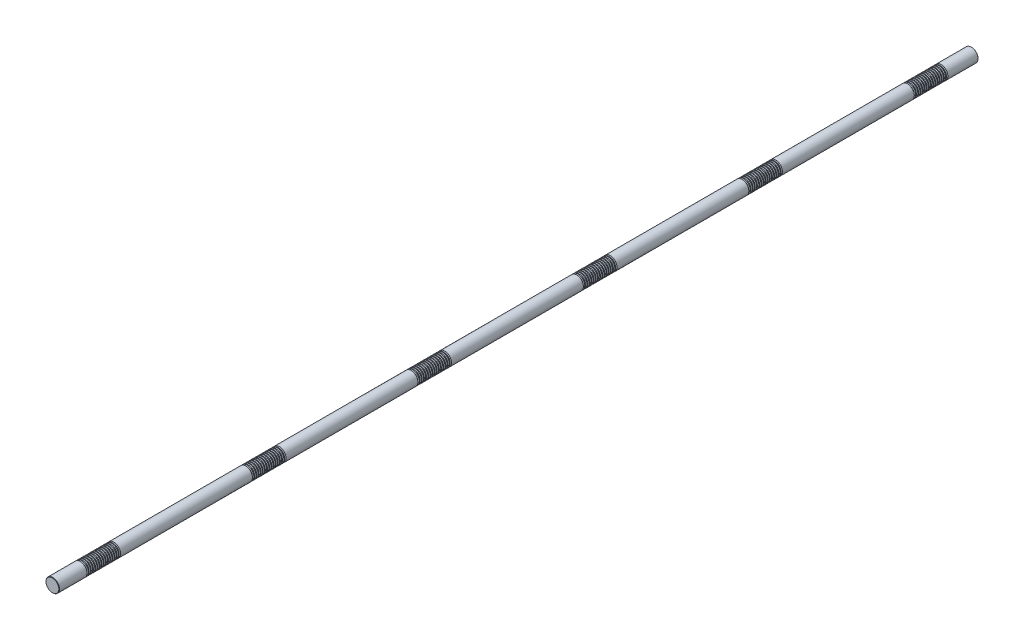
SolidWorks part; units mm, degrees
ref_plane "Front Plane" through (0, 0, 0) normal (0, 0, 1) x (1, 0, 0)
ref_plane "Top Plane" through (0, 0, 0) normal (0, 1, 0) x (1, 0, 0)
ref_plane "Right Plane" through (0, 0, 0) normal (1, 0, 0) x (0, 0, -1)
sketch "Sketch1" plane through (0, 0, 0) normal (0, 0, 1) x (1, 0, 0)
  circle A0 centre (0, 0) radius 22
  dimension "D1" = 44
extrude "Boss-Extrude1" add sketch "Sketch1" along normal mid plane 3000
chamfer "Chamfer1" distance 1.1 angle 45 2 edges at (22, 0, -1500) (22, 0, 1500)
sketch "Sketch2" plane through (0, 0, 0) normal (1, 0, 0) x (0, 0, -1)
  line L0 (1400.5359, 22) -> (1395.9641, 22)
  line L1 (1498.9, 22) -> (-1498.9, 22) construction
  line L2 (1395.9641, 22) -> (1397.0359, 18)
  line L3 (1397.0359, 18) -> (1399.4641, 18)
  line L4 (1399.4641, 18) -> (1400.5359, 22)
  line L5 (1500, -20.9) -> (1500, 20.9) construction
  point P4 (1398.25, 22)
  point P7 (1398.25, 18)
  point P8 (1400, 20)
  point P9 (1396.5, 20)
  dimension "D1" = 3.5
  dimension "D2" = 100
  dimension "D3" = 4
  dimension "D4" = 30
revolve "Cut-Revolve1" cut sketch "Sketch2" angle 360 about axis through (0, 0, 1500) along (0, 0, -1)
pattern_linear "LPattern1" count 16 spacing 7 along (0, 0, 1) of "Cut-Revolve1"
pattern_linear "LPattern2" count 6 spacing 540 along (0, 0, 1) of "Cut-Revolve1", "LPattern1"
